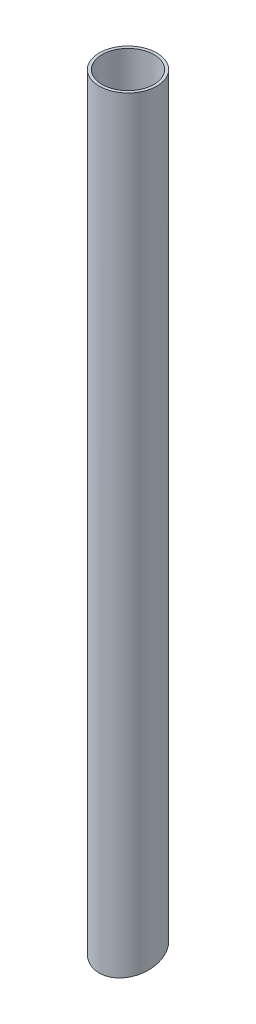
SolidWorks part; units mm, degrees
ref_plane "Vorne" through (0, 0, 0) normal (0, 0, 1) x (1, 0, 0)
ref_plane "Oben" through (0, 0, 0) normal (0, 1, 0) x (1, 0, 0)
ref_plane "Rechts" through (0, 0, 0) normal (1, 0, 0) x (0, 0, -1)
sketch "Skizze1" plane through (0, 0, 0) normal (0, 1, 0) x (1, 0, 0)
  circle A0 centre (0, 0) radius 15
  dimension "D1" = 30
extrude "Linear-Austragen-Dünn1" add sketch "Skizze1" along normal blind 400 thin
sketch "Skizze5" plane through (0, 0, 0) normal (0, 0, -1) x (-1, 0, 0)
  line L0 (-15, 0) -> (-46.4505, 86.4095)
  line L2 (-15, 0) -> (69.0443, 30.5896)
  line L3 (-15, 400) -> (-15, 0) construction
  dimension "D1" = 20
sketch "Skizze6" plane through (0, 0, 0) normal (1, 0, 0) x (0, 0, -1)
  line L0 (15, 8.0385) -> (-15, 0) construction
  line L1 (15, 8.0385) -> (-15, 0)
extrude "Schnitt-Linear austragen1" cut sketch "Skizze6" against normal through all and the other way through all
sketch "Skizze8" plane through (0, 0, 0) normal (0, 0, 1) x (1, 0, 0)
  line L1 (-15, 400) -> (15, 400)
  line L2 (-15, 400) -> (-15, 0)
  line L3 (-15, 0) -> (15, 0)
  line L4 (15, 400) -> (15, 0)
